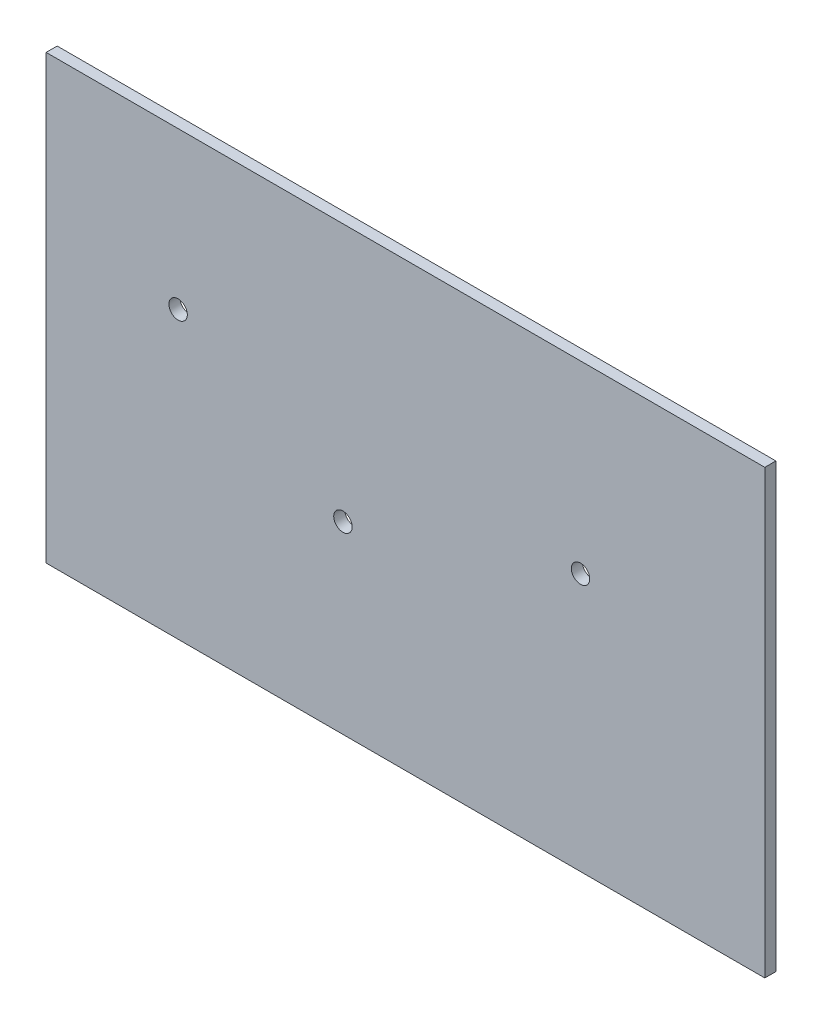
SolidWorks part; units mm, degrees
ref_plane "Plan de face" through (0, 0, 0) normal (0, 0, 1) x (1, 0, 0)
ref_plane "Plan de dessus" through (0, 0, 0) normal (0, 1, 0) x (1, 0, 0)
ref_plane "Plan de droite" through (0, 0, 0) normal (1, 0, 0) x (0, 0, -1)
sketch "Esquisse1" plane through (0, 0, 0) normal (0, 0, 1) x (1, 0, 0)
  line L1 (-75.7745, 50.7636) -> (119.2255, 50.7636)
  line L2 (-75.7745, 50.7636) -> (-75.7745, -69.2364)
  line L3 (-75.7745, -69.2364) -> (119.2255, -69.2364)
  line L4 (119.2255, 50.7636) -> (119.2255, -69.2364)
  dimension "D1" = 195
  dimension "D2" = 120
extrude "Extrusion1" add sketch "Esquisse1" along normal blind 3
sketch "Esquisse2" plane through (0, 0, 3) normal (0, 0, 1) x (1, 0, 0)
  line L4 (119.2255, -69.2364) -> (119.2255, 50.7636) construction
  line L6 (119.2255, 50.7636) -> (-75.7745, 50.7636) construction
  line L7 (-75.7745, -69.2364) -> (119.2255, -69.2364) construction
  circle A0 centre (69.2255, 0.7636) radius 2.5
  circle A1 centre (4.7565, -19.2364) radius 2.5
  circle A2 centre (-39.9648, 8.2636) radius 2.5
  dimension "D1" = 5
  dimension "D2" = 5
  dimension "D3" = 5
  dimension "D4" = 50
  dimension "D5" = 50
  dimension "D6" = 67.5
  dimension "D9" = 40
  dimension "D7" = 50
  dimension "D8" = 52.5
extrude "Enlèv. mat.-Extru.1" cut sketch "Esquisse2" against normal through all
